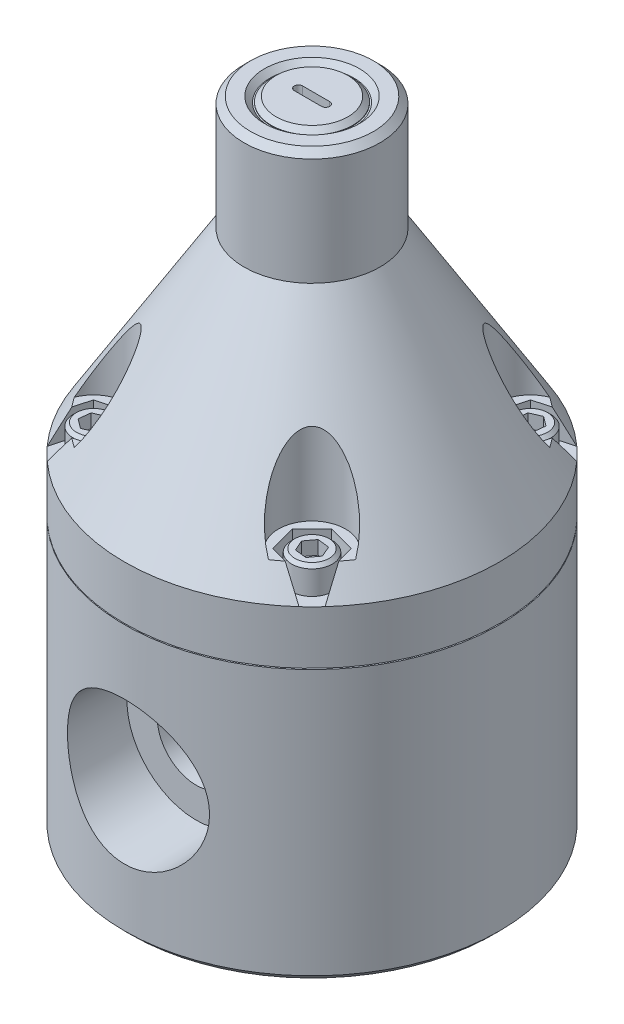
SolidWorks part; units mm, degrees
ref_plane "Front Plane" through (0, 0, 0) normal (0, 0, 1) x (1, 0, 0)
ref_plane "Top Plane" through (0, 0, 0) normal (0, 1, 0) x (1, 0, 0)
ref_plane "Right Plane" through (0, 0, 0) normal (1, 0, 0) x (0, 0, -1)
sketch "Sketch1" plane through (0, 0, 0) normal (0, 1, 0) x (1, 0, 0)
  circle A0 centre (0, 0) radius 43.815
  dimension "D1" = 87.63
extrude "Extrude1" add sketch "Sketch1" along normal blind 148.59
sketch "Sketch2" plane through (0, 0, 0) normal (0, 0, 1) x (1, 0, 0)
  line L0 (0, 148.59) -> (0, 0) construction
  line L1 (43.815, 148.59) -> (-43.815, 148.59) construction
  line L2 (-52.6288, 63.5) -> (-30.226, 63.5)
  line L4 (-30.226, 63.5) -> (-30.226, 63.754)
  line L5 (-30.226, 63.754) -> (-43.815, 63.754)
  line L7 (-43.815, 63.754) -> (-43.815, 76.2)
  line L8 (-43.815, 76.2) -> (-15.875, 121.92)
  line L9 (-15.875, 121.92) -> (-15.875, 152.4)
  line L10 (-15.875, 152.4) -> (-52.6288, 152.4)
  line L11 (-52.6288, 152.4) -> (-52.6288, 63.5)
  line L12 (-43.815, 0) -> (43.815, 0) construction
  dimension "D1" = 43.815
  dimension "D2" = 15.875
  dimension "D3" = 63.5
  dimension "D4" = 30.226
  dimension "D5" = 0.254
  dimension "D6" = 76.2
  dimension "D7" = 152.4
  dimension "D8" = 121.92
revolve "Cut-Revolve1" cut sketch "Sketch2" angle 360 about L0
chamfer "Chamfer1" distance 1.524 angle 45 2 edges at (0, 0, 43.815) (0, 148.59, 15.875)
ref_plane "Plane1" through (0, 148.59, 0) normal (0, 1, 0) x (-1, 0, 0)
sketch "Sketch3" plane through (0, 148.59, 0) normal (0, 1, 0) x (-1, 0, 0)
  circle A0 centre (0, 0) radius 11.1125
  dimension "D1" = 22.225
extrude "Extrude2" cut sketch "Sketch3" against normal blind 1.27 draft 45
sketch "Sketch4" plane through (0, 148.59, 0) normal (0, 1, 0) x (-1, 0, 0)
  circle A0 centre (0, 0) radius 9.525
  dimension "D1" = 19.05
extrude "Extrude3" add sketch "Sketch4" against normal up to surface (1.27 mm away)
chamfer "Chamfer2" distance 1.143 angle 45 1 edges at (0, 148.59, 9.525)
sketch "Sketch5" plane through (0, 148.59, 0) normal (0, 1, 0) x (-1, 0, 0)
  line L0 (3.175, 0) -> (-3.175, 0) construction
  line L1 (3.175, 0.9652) -> (-3.175, 0.9652)
  line L2 (-3.175, -0.9652) -> (3.175, -0.9652)
  arc A0 (-3.175, 0.9652) -> (-3.175, -0.9652) centre (-3.175, 0) ccw
  arc A1 (3.175, -0.9652) -> (3.175, 0.9652) centre (3.175, 0) ccw
  dimension "D1" = 3.175
  dimension "D2" = 6.35
  dimension "D3" = 0.9652
  dimension "D4" = 0.9652
extrude "Extrude4" cut sketch "Sketch5" against normal blind 3.175 draft 1
ref_plane "Plane2" through (0, 82.55, 0) normal (0, 1, 0) x (-1, 0, 0)
sketch "Sketch6" plane through (0, 82.55, 0) normal (0, 1, 0) x (-1, 0, 0)
  line L0 (0, 0) -> (-30.9819, 30.9819) construction
  circle A0 centre (0, 0) radius 36.0934 construction
  circle A1 centre (0, 0) radius 43.815 construction
  circle A2 centre (-25.5219, 25.5219) radius 7.874
  dimension "D1" = 15.748
extrude "Extrude5" cut sketch "Sketch6" along normal blind 22.86
sketch "Sketch7" plane through (0, 82.55, 0) normal (0, 1, 0) x (-1, 0, 0)
  line L0 (0, 0) -> (-25.5219, 25.5219) construction
  line L1 (-25.5219, 25.5219) -> (-31.0896, 19.9541) construction
  line L2 (-25.5219, 25.5219) -> (-19.9541, 31.0896) construction
  line L3 (-25.5219, 25.5219) -> (-39.3911, 39.3911) construction
  line L4 (-30.0845, 20.9593) -> (-23.8519, 19.2893)
  line L5 (-23.8519, 19.2893) -> (-19.2893, 23.8519)
  line L6 (-19.2893, 23.8519) -> (-20.9593, 30.0845)
  line L10 (-30.0845, 20.9593) -> (-33.6536, 33.6536)
  line L11 (-33.6536, 33.6536) -> (-20.9593, 30.0845)
  line L13 (-27.1919, 31.7545) -> (-31.7545, 27.1919)
  line L14 (-20.9593, 30.0845) -> (-27.1919, 31.7545)
  line L15 (-31.7545, 27.1919) -> (-30.0845, 20.9593)
  arc A0 (-32.8666, 22.6837) -> (-22.6837, 32.8666) centre (-25.5219, 25.5219) ccw construction
  circle A1 centre (-25.5219, 25.5219) radius 5.588 construction
extrude "Extrude6" cut sketch "Sketch7" against normal blind 6.35
sketch "Sketch8" plane through (0, 82.55, 0) normal (0, 1, 0) x (-1, 0, 0)
  circle A0 centre (-25.5219, 25.5219) radius 4.7625
  dimension "D1" = 9.525
extrude "Extrude7" add sketch "Sketch8" against normal up to surface (6.35 mm away)
sketch "Sketch9" plane through (0, 82.55, 0) normal (0, 1, 0) x (-1, 0, 0)
  line L1 (-23.8739, 27.7452) -> (-26.6233, 28.0608)
  line L2 (-26.6233, 28.0608) -> (-28.2713, 25.8375)
  line L3 (-28.2713, 25.8375) -> (-27.1699, 23.2986)
  line L4 (-27.1699, 23.2986) -> (-24.4205, 22.983)
  line L5 (-24.4205, 22.983) -> (-22.7725, 25.2063)
  line L6 (-22.7725, 25.2063) -> (-23.8739, 27.7452)
  circle A0 centre (-25.5219, 25.5219) radius 2.3967 construction
extrude "Extrude8" cut sketch "Sketch9" against normal blind 3.175
pattern_circular "CirPattern1" count 4 over 360 about axis through (0, 0, 0) along (0, 1, 0) of "Extrude5", "Extrude6", "Extrude7", "Extrude8"
chamfer "Chamfer3" distance 0.762 angle 45 4 edges at (25.5219, 82.55, 30.2844) (30.2844, 82.55, -25.5219) (-25.5219, 82.55, -30.2844) (-30.2844, 82.55, 25.5219)
ref_plane "Plane3" through (0, 0, 43.815) normal (0, 0, 1) x (1, 0, 0)
hole_wizard "1 NPT Tapped Hole1" positions "3DSketch1" profile "Sketch12" size "1" standard "Ansi Inch"
sketch3d "3DSketch1"
  point P0 (0, 31.75, 43.815)
sketch "Sketch12" plane through (0, 31.75, 43.815) normal (1, 0, 0) x (0, -1, 0)
  line L0 (0, 0) -> (0, 30.879)
  line L1 (9.1186, 25.4) -> (0, 30.879)
  line L2 (-9.1186, 25.4) -> (0, 30.879) construction
  line L3 (9.1186, 25.4) -> (9.1186, 16.764)
  line L4 (9.1186, 16.764) -> (16.1979, 16.764)
  line L5 (16.1979, 16.764) -> (16.6998, 0)
  line L6 (-16.1979, 16.764) -> (-16.6998, 0) construction
  line L7 (16.6998, 0) -> (0, 0)
  line L8 (0, -6.35) -> (0, 107.95) construction
  line L11 (-9.1186, 16.764) -> (-16.1979, 16.764) construction
  dimension "Tap Drill Dia." = 18.2372
  dimension "Tap Drill Depth" = 25.4
  dimension "Thread Dia." = 33.3996
  dimension "Thread Angle" = 3.43
  dimension "Thread Depth" = 16.764
  dimension "Drill Angle" = 118
mirror "Mirror1" about plane through (0, 0, 0) normal (0, 0, 1) of "1 NPT Tapped Hole1"
